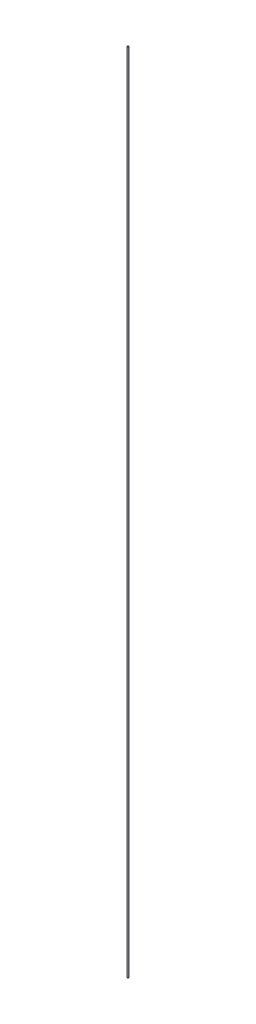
SolidWorks part; units mm, degrees
ref_plane "Plan de face" through (0, 0, 0) normal (0, 0, 1) x (1, 0, 0)
ref_plane "Plan de dessus" through (0, 0, 0) normal (0, 1, 0) x (1, 0, 0)
ref_plane "Plan de droite" through (0, 0, 0) normal (1, 0, 0) x (0, 0, -1)
sketch "Esquisse1" plane through (0, 0, 0) normal (0, 1, 0) x (1, 0, 0)
  circle A0 centre (0, 0) radius 1.5
  dimension "D1" = 3
extrude "Extrusion1" add sketch "Esquisse1" along normal blind 1880
